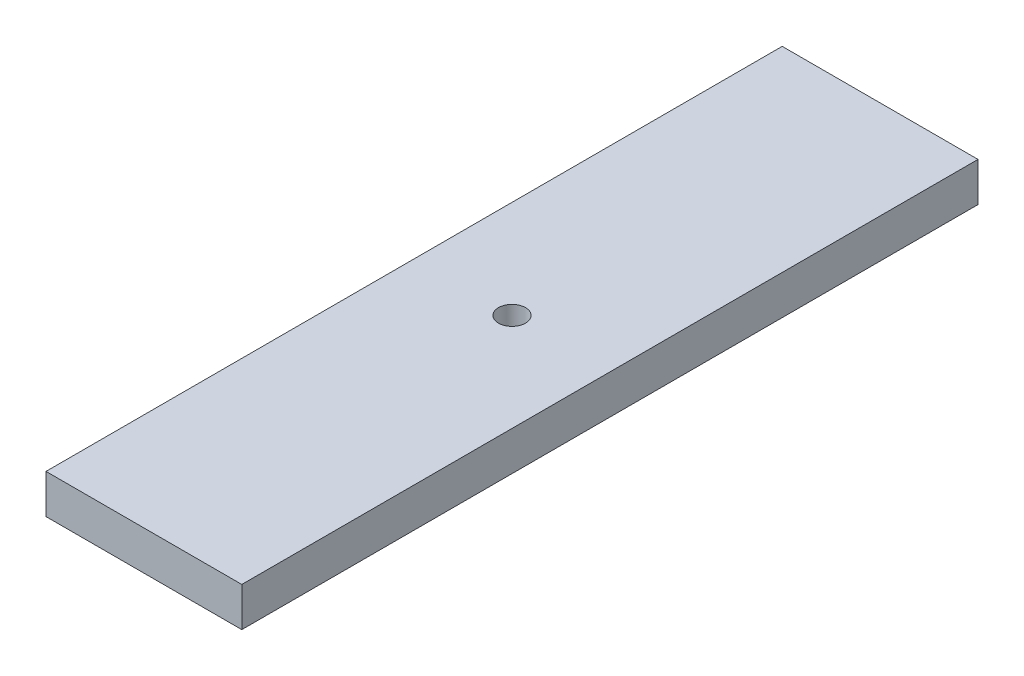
SolidWorks part; units mm, degrees
ref_plane "Plan1" through (0, 0, 0) normal (0, 0, 1) x (1, 0, 0)
ref_plane "Plan2" through (0, 0, 0) normal (0, 1, 0) x (1, 0, 0)
ref_plane "Plan3" through (0, 0, 0) normal (1, 0, 0) x (0, 0, -1)
sketch "Esquisse1" plane through (0, 0, 0) normal (0, 0, 1) x (1, 0, 0)
  line L0 (0, 6.5896) -> (0, -6.5896) construction
  line L1 (25, -5) -> (-25, -5)
  line L2 (25, -5) -> (25, 5)
  line L3 (25, 5) -> (-25, 5)
  line L4 (-25, -5) -> (-25, 5)
  line L5 (-7.9761, 0) -> (7.9761, 0) construction
  dimension "D1" = 10
  dimension "D2" = 50
extrude "Base-Extrusion" add sketch "Esquisse1" along normal mid plane 188
sketch "Esquisse2" plane through (0, 5, 0) normal (0, 1, 0) x (-1, 0, 0)
  circle A0 centre (0, 0) radius 3.45
  dimension "D1" = 6.9
extrude "Enlèv. mat.-Extru.1" cut sketch "Esquisse2" against normal through all
